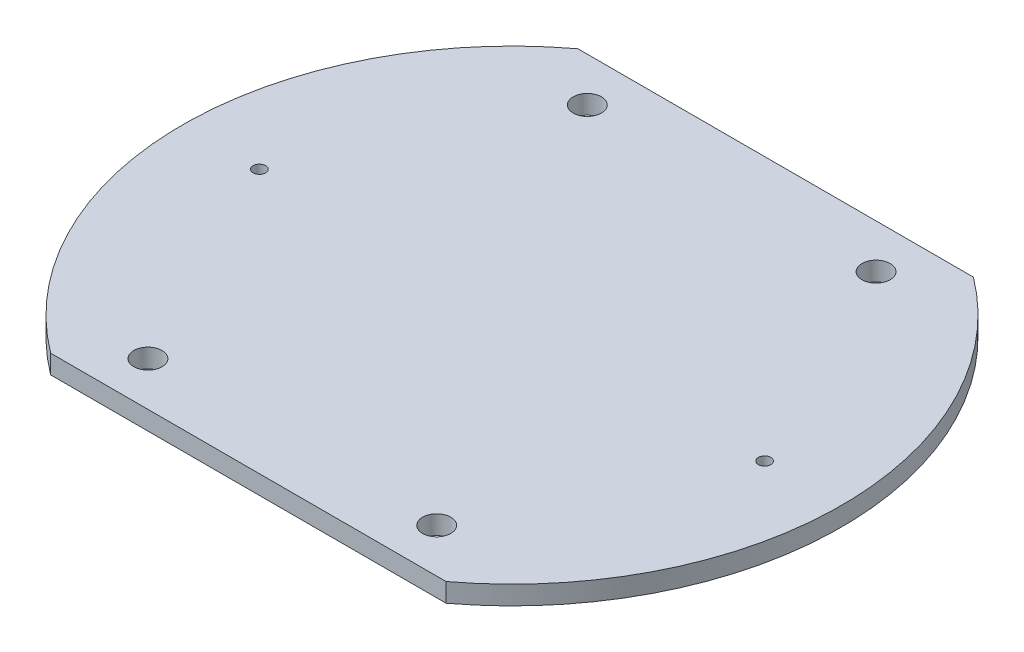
SolidWorks part; units mm, degrees
ref_plane "Front Plane" through (0, 0, 0) normal (0, 0, 1) x (1, 0, 0)
ref_plane "Top Plane" through (0, 0, 0) normal (0, 1, 0) x (1, 0, 0)
ref_plane "Right Plane" through (0, 0, 0) normal (1, 0, 0) x (0, 0, -1)
inserted part "params_print"
sketch "Base Sketch" plane through (0, 0, 0) normal (0, 1, 0) x (1, 0, 0)
  line L0 (0, 52.5) -> (0, 0) construction
  line L1 (0, 0) -> (-52.5, 0) construction
  circle A0 centre (0, 0) radius 52.5
  circle A1 centre (-23, 35) radius 1
  circle A2 centre (-40.25, 0) radius 1
  circle A3 centre (40.25, 0) radius 1
  circle A4 centre (23, 35) radius 1
  circle A5 centre (23, -35) radius 1
  circle A6 centre (-23, -35) radius 1
  dimension "D1" = 23
  dimension "base diameter" = 105
  dimension "D4" = 2
  dimension "D2" = 35
  dimension "D3" = 40.25
extrude "Base" add sketch "Base Sketch" along normal blind 3
sketch "Sketch2" plane through (0, 3, 0) normal (0, 1, 0) x (1, 0, 0)
  line L0 (0, 0) -> (-52.5, 0) construction
  line L1 (-31.5, 42) -> (31.5, 42)
  line L2 (-31.5, 42) -> (-31.5, 52.5)
  line L3 (-31.5, 52.5) -> (31.5, 52.5)
  line L4 (31.5, 42) -> (31.5, 52.5)
  line L5 (31.5, -42) -> (31.5, -52.5)
  line L6 (-31.5, -52.5) -> (31.5, -52.5)
  line L7 (-31.5, -42) -> (-31.5, -52.5)
  line L8 (-31.5, -42) -> (31.5, -42)
  circle A0 centre (0, 0) radius 52.5 construction
  dimension "D1" = 42
extrude "Side Cut" cut sketch "Sketch2" against normal through all
hole_wizard "#8 Clearance Hole1" positions "Sketch4" profile "Sketch3" hole size "#8" standard "ANSI Inch"
sketch "Sketch4" plane through (0, 3, 0) normal (0, 1, 0) x (1, 0, 0)
  point P0 (-23, 35)
  point P3 (23, 35)
  point P6 (23, -35)
  point P9 (-23, -35)
sketch "Sketch3" plane through (-23, 3, -35) normal (1, 0, 0) x (0, 0, 1)
  line L0 (0, 0) -> (0, 27.7507)
  line L1 (0, 27.7507) -> (2.2479, 26.4)
  line L2 (2.2479, 26.4) -> (2.2479, 0)
  line L5 (2.2479, 0) -> (0, 0)
  line L10 (0, 27.7507) -> (-2.2479, 26.4) construction
  line L11 (0, -6.35) -> (0, 107.95) construction
  dimension "Hole Dia." = 4.4958
  dimension "Hole Depth" = 26.4
  dimension "Drill Angle" = 118
equation "\"D1@Base\"=\"width keep@values@params_print.SLDPRT\""
